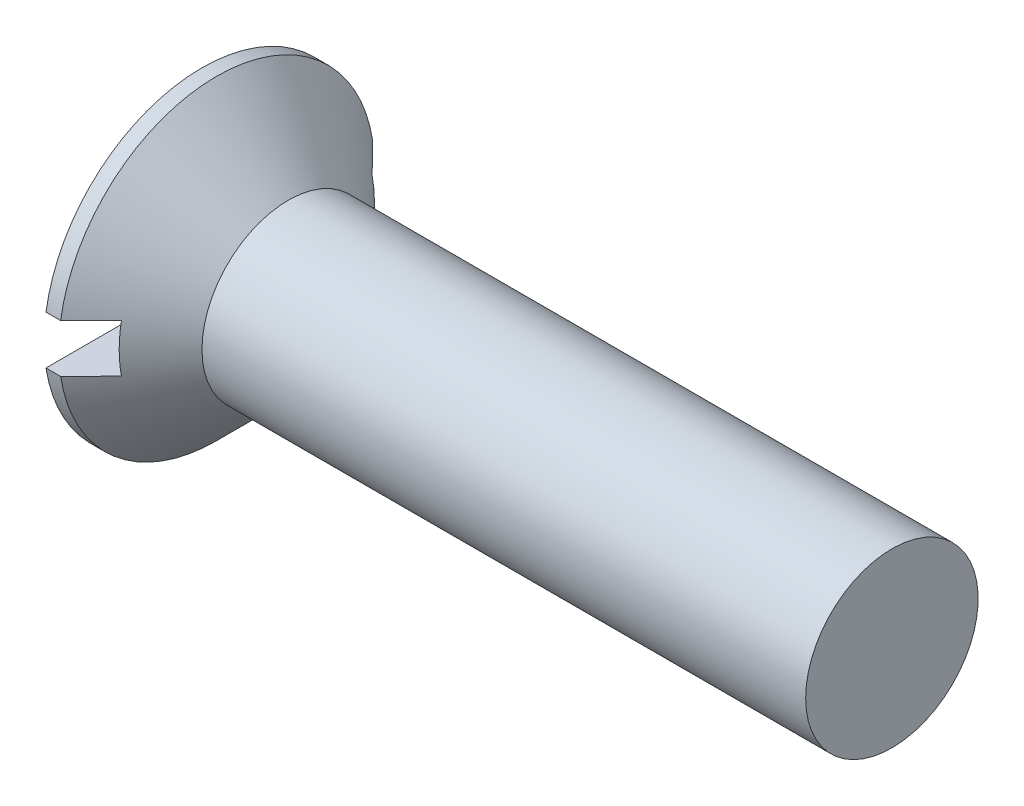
SolidWorks part; units mm, degrees
revolve "Base-Revolve" add sketch "BodySke" angle 360 about L5
sketch "BodySke" plane through (0, 0, 0) normal (0, 0, 1) x (1, 0, 0)
  line L0 (0, 0) -> (0, 9.15)
  line L1 (0, 9.15) -> (0.85, 9.15)
  line L2 (5, 5) -> (40, 5)
  line L3 (40, 5) -> (40, 0)
  line L4 (40, 0) -> (0, 0)
  line L5 (-6.35, 0) -> (82.55, 0) construction
  line L6 (5, -5) -> (40, -5) construction
  line L7 (0.85, -9.15) -> (5, -5) construction
  line L8 (0.85, 9.15) -> (5, 5)
  line L9 (0, -9.15) -> (0.85, -9.15) construction
  line L10 (6.5, 6.5875) -> (6.5, -2.9375) construction
  line L11 (5, 6.35) -> (5, -3.175) construction
extrude "Slot" cut sketch "Sketch2" against normal blind 2.6
sketch "Sketch2" plane through (0, 0, 0) normal (-1, 0, 0) x (0, 0, 1)
  line L0 (-9.15, -1.4) -> (9.15, -1.4)
  line L1 (-9.15, -1.4) -> (-9.15, 1.4)
  line L2 (9.15, 1.4) -> (-9.15, 1.4)
  line L3 (9.15, 1.4) -> (9.15, -1.4)
ref_plane "Plane1" through (0, 0, 0) normal (0, 0, 1) x (1, 0, 0)
ref_plane "Plane2" through (0, 0, 0) normal (0, 1, 0) x (1, 0, 0)
ref_plane "Plane3" through (0, 0, 0) normal (1, 0, 0) x (0, 0, -1)
other "Configuration Table"
sketch "Sketch3" plane through (0, 0, 0) normal (-1, 0, 0) x (0, 0, 1)
  line L0 (-0.99, 4.94) -> (0.99, 4.94)
  line L1 (0.99, 4.94) -> (0.99, -4.94)
  line L2 (0.99, -4.94) -> (-0.99, -4.94)
  line L3 (-0.99, -4.94) -> (-0.99, 4.94)
ref_plane "Plane4" through (5.98, 0, 0) normal (-1, 0, 0) x (0, 0, 1)
sketch "Sketch4" plane through (5.98, 0, 0) normal (-1, 0, 0) x (0, 0, 1)
  line L0 (-0.495, 0.495) -> (0.495, 0.495)
  line L3 (0.495, 0.495) -> (0.495, -0.495)
  line L4 (0.495, -0.495) -> (-0.495, -0.495)
  line L5 (-0.495, -0.495) -> (-0.495, 0.495)
loft "Cross" cut profiles "Sketch3", "Sketch4"
pattern_circular "CirPattern1" count 2 every 90 about axis through (0, 0, 0) along (1, 0, 0) of "Cross"
sketch "ThdSchSke" plane through (0, 0, 0) normal (0, 0, 1) x (1, 0, 0)
  line L0 (6.5, -4.172) -> (5.9202, -5)
  line L1 (6.5, -4.172) -> (7.0798, -5)
  line L2 (7.0798, -5) -> (7.0798, -6.25)
  line L3 (-3.175, 0) -> (5.1513, 0) construction
  line L5 (7.0798, -6.25) -> (5.9202, -6.25)
  line L6 (5.9202, -6.25) -> (5.9202, -5)
  line L7 (0, 9.15) -> (0, 1.4) construction
revolve "ThreadSchematic" [suppressed] cut sketch "ThdSchSke" angle 360 about L3
pattern_linear "ThdSchPat" [suppressed]
equation "\"D1@Sketch3\" = \"Cross_dia@Sketch3\" / 2"
equation "\"D2@Sketch3\" = \"Cross_width@Sketch3\" / 2"
equation "\"D1@Sketch4\" = \"Cross_width@Sketch3\" *.5"
equation "\"D2@Sketch4\" = \"D1@Sketch4\""
equation "\"D4@Sketch4\" = \"D2@Sketch4\" / 2"
equation "\"D3@Sketch4\" = \"D1@Sketch4\" / 2"
equation "\"D1@Sketch2\" = \"Slot_width@Sketch2\" / 2"
equation "\"D2@Sketch2\" = \"Head_dia@BodySke\""
equation "\"D3@Sketch2\" = \"D2@Sketch2\" / 2"
equation "\"Thread_length@ThreadCosmetic\" = ((sgn( (\"Length@BodySke\" - \"Advance@BodySke\" - \"Head_ht@BodySke\" ) - \"Thread_nom@BodySke\" )-1)*( (\"Length@BodySke\" - \"Advance@BodySke\" - \"Head_ht@BodySke\" ) - \"Thread_"
equation "\"Thread_minor@ThdSchSke\" = \"Thread_minor@ThreadCosmetic\""
equation "\"Diameter@ThdSchSke\" = \"Diameter@BodySke\""
equation "\"Overcut@ThdSchSke\" = \"Diameter@BodySke\" * 1.25"
equation "\"Start@ThdSchSke\" = 0.000001 + \"Length@BodySke\" - \"Thread_length@ThreadCosmetic\"  '---Countersunk---"
equation "\"Num_threads@ThdSchPat\" = int( \"Thread_length@ThreadCosmetic\" / \"Advance@BodySke\" + 0.999 )  + 1"
equation "\"Advance@ThdSchPat\" = \"Thread_length@ThreadCosmetic\" /  (\"Num_threads@ThdSchPat\" - 1) 'relax it"
